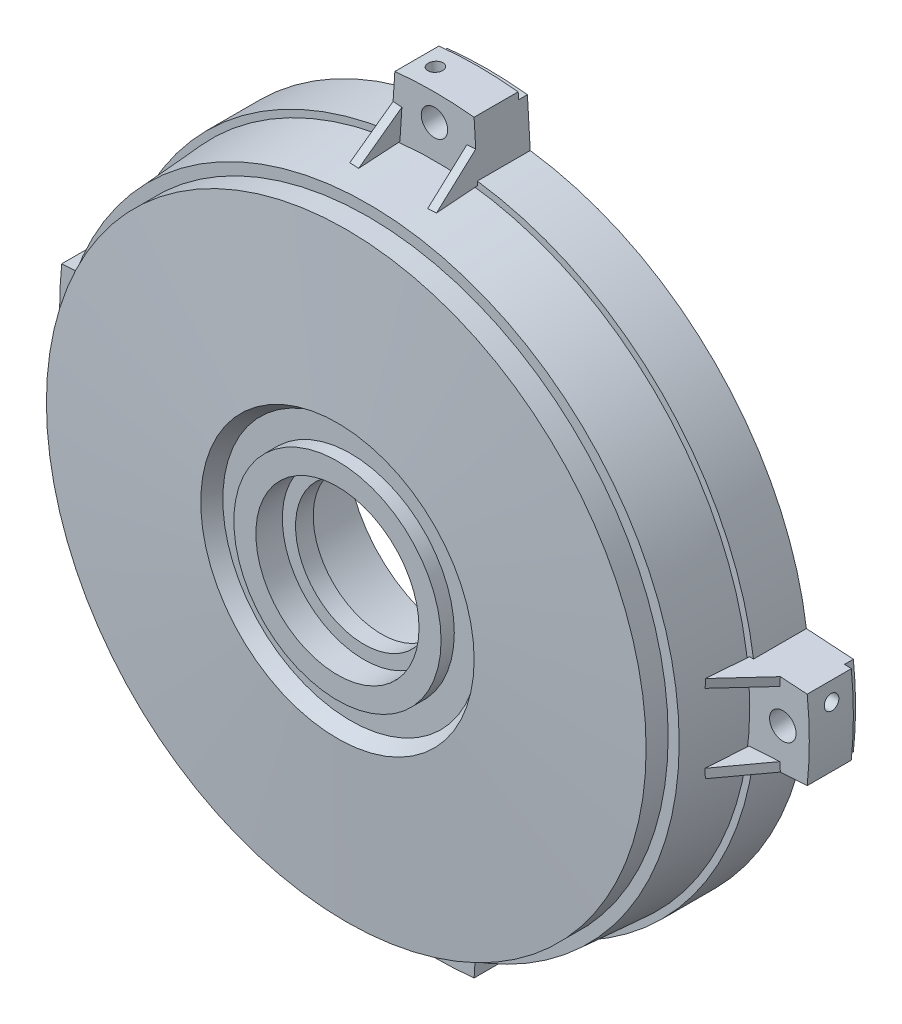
SolidWorks part; units mm, degrees
ref_plane "前视基准面" through (0, 0, 0) normal (0, 0, 1) x (1, 0, 0)
ref_plane "上视基准面" through (0, 0, 0) normal (0, 1, 0) x (1, 0, 0)
ref_plane "右视基准面" through (0, 0, 0) normal (1, 0, 0) x (0, 0, -1)
sketch "草图1" plane through (0, 0, 0) normal (0, 1, 0) x (1, 0, 0)
  line L0 (0, 0) -> (0, 28.0084) construction
  line L1 (15.5, 5.0884) -> (22.5, 5.0884)
  line L2 (22.5, 5.0884) -> (22.5, 6.0884)
  line L3 (22.5, 6.0884) -> (26, 6.0884)
  line L4 (26, 6.0884) -> (26, 23.0884)
  line L5 (26, 23.0884) -> (34, 23.0884)
  line L6 (34, 23.0884) -> (34, 4.0332)
  line L7 (15.5, 5.0884) -> (15.5, 1.0884)
  line L8 (15.5, 1.0884) -> (18.5, 1.0884)
  line L9 (18.5, 1.0884) -> (18.5, -4.9116)
  line L10 (18.5, -4.9116) -> (23.5, -4.9116)
  line L11 (23.5, -4.9116) -> (23.5, -1.9116)
  line L12 (23.5, -1.9116) -> (29, -1.9116)
  line L13 (29, -1.9116) -> (31, -4.9116)
  line L14 (31, -4.9116) -> (68, -2.9116)
  line L15 (68, -2.9116) -> (68, 2.0884)
  line L16 (68, 2.0884) -> (70.5, 2.0884)
  line L17 (70.5, 2.0884) -> (71.5, 17.0884)
  line L18 (71.5, 17.0884) -> (73, 17.0884)
  line L19 (73, 17.0884) -> (73, 29.0884)
  line L20 (73, 29.0884) -> (70, 29.0884)
  line L21 (67.2333, 5.5884) -> (70, 29.0884)
  line L22 (67.2333, 5.5884) -> (64.5, 5.5884)
  line L23 (64.5, 5.5884) -> (64.5, 0.4043)
  line L24 (64.5, 0.4043) -> (39.2699, -0.9595)
  arc A0 (39.2699, -0.9595) -> (34, 4.0332) centre (39, 4.0332) cw
  dimension "D25" = 5
  dimension "D1" = 15.5
  dimension "D2" = 22.5
  dimension "D3" = 26
  dimension "D4" = 1
  dimension "D5" = 17
  dimension "D6" = 34
  dimension "D7" = 18.5
  dimension "D8" = 23.5
  dimension "D9" = 6
  dimension "D10" = 3
  dimension "D11" = 29
  dimension "D12" = 31
  dimension "D13" = 2
  dimension "D14" = 5
  dimension "D15" = 68
  dimension "D16" = 70.5
  dimension "D17" = 71.5
  dimension "D18" = 73
  dimension "D19" = 24
  dimension "D20" = 70
  dimension "D21" = 34
  dimension "D22" = 12
  dimension "D23" = 3.5
  dimension "D24" = 3.5
revolve "旋转1" add sketch "草图1" angle 360 about L0
sketch "草图2" plane through (0, 0, -29.0884) normal (0, 0, -1) x (-1, 0, 0)
  circle A0 centre (0, 0) radius 70
extrude "切除-拉伸1" cut sketch "草图2" against normal blind 4
sketch "草图3" plane through (0, 0, -29.0884) normal (0, 0, -1) x (-1, 0, 0)
  line L0 (-8.9874, 84.5235) -> (-9.9009, 69.2963)
  line L1 (8.9874, 84.5235) -> (9.9745, 69.2857)
  arc A0 (8.9874, 84.5235) -> (-8.9874, 84.5235) centre (0, 0) ccw
  arc A1 (9.9745, 69.2857) -> (-9.9009, 69.2963) centre (0, 0) ccw
extrude "凸台-拉伸1" add sketch "草图3" against normal up to surface (12 mm away)
pattern_circular "阵列(圆周)1" count 4 over 360 about axis through (0, 0, 0) along (0, 0, 1) of "凸台-拉伸1"
sketch "草图4" plane through (0, 0, -29.0884) normal (0, 0, -1) x (-1, 0, 0)
  circle A0 centre (0, 0) radius 83.5
extrude "切除-拉伸2" cut sketch "草图4" against normal blind 2 flip side to cut
sketch "草图6" plane through (0, 0, 0) normal (0, 1, 0) x (1, 0, 0)
  line L0 (-64.5464, 0.4252) -> (-33.2767, -1.4057)
ref_plane "基准面1" through (-64.5464, 0, -0.4252) normal (0.9983, 0, 0.0585) x (0.0585, 0, -0.9983)
sketch "草图7" plane through (-64.5464, 0, -0.4252) normal (0.9983, 0, 0.0585) x (0.0585, 0, -0.9983)
  line L5 (-0.0934, 2) -> (-0.0934, -2)
  line L6 (-0.0934, 2) -> (2.9066, 2)
  line L7 (2.9066, 2) -> (2.9066, -2)
  line L8 (2.9066, -2) -> (-0.0934, -2)
sweep "扫描1" add profiles "草图7" path "草图6"
pattern_circular "阵列(圆周)3" count 8 over 360 about axis through (0, 0, 0) along (0, 0, 1) of "扫描1"
sketch "草图8" plane through (0, 0, -23.0884) normal (0, 0, -1) x (-1, 0, 0)
  circle A1 centre (0, 31) radius 5
extrude "凸台-拉伸2" add sketch "草图8" against normal blind 22
pattern_circular "阵列(圆周)4" count 3 over 360 about axis through (0, 0, 0) along (0, 0, 1) of "凸台-拉伸2"
sketch "草图9" plane through (0, 0, -23.0884) normal (0, 0, -1) x (-1, 0, 0)
  circle A1 centre (0, 31) radius 2.05
extrude "切除-拉伸4" cut sketch "草图9" against normal blind 2.05 draft 45
pattern_circular "阵列(圆周)5" count 3 over 360 about axis through (0, 0, 0) along (0, 0, 1) of "切除-拉伸4"
ref_plane "基准面2" through (85, 0, 0) normal (1, 0, 0) x (0, 0, -1)
hole_wizard "M4 螺纹孔1" positions "3D草图1" profile "草图10" tap size "M4" standard "GB"
sketch3d "3D草图1"
  point P0 (84.8543, 4.9752, -22.2864)
sketch "草图10" plane through (84.8543, 4.9752, -22.2864) normal (0, 0, 1) x (-0.0585, 0.9983, 0)
  line L0 (0, 0) -> (0, 9.9914)
  line L1 (0, 9.9914) -> (1.65, 9)
  line L2 (1.65, 9) -> (1.65, 0)
  line L5 (1.65, 0) -> (0, 0)
  line L10 (0, 9.9914) -> (-1.65, 9) construction
  line L11 (0, -6.35) -> (0, 107.95) construction
  dimension "螺纹孔钻头直径" = 3.3
  dimension "螺纹孔钻头深度" = 9
  dimension "导头角度" = 118
pattern_circular "阵列(圆周)6" count 4 over 360 about axis through (0, 0, 0) along (0, 0, 1) of "M4 螺纹孔1"
sketch "草图11" plane through (14.0078, 0.8404, 0) normal (0.9982, 0.0599, 0) x (0, 0, -1)
  line L0 (17.0884, 77.7361) -> (7.7308, 70.0802)
  line L1 (17.0884, 83.8336) -> (17.0884, 71.6385) construction
  line L2 (7.7308, 70.0802) -> (17.0884, 70.7659)
  line L3 (17.0884, 70.7659) -> (17.0884, 77.7361)
extrude "凸台-拉伸3" add sketch "草图11" against normal blind 2
pattern_circular "阵列(圆周)7" count 4 over 360 about axis through (0, 0, 0) along (0, 0, 1) of "凸台-拉伸3"
sketch "草图12" plane through (-14.4022, 0.933, 0) normal (-0.9979, 0.0646, 0) x (0, 0, 1)
  line L1 (-17.0884, 71.5591) -> (-17.0884, 83.7658) construction
  line L2 (-17.0884, 77.6624) -> (-17.0884, 70.6761)
  line L4 (-17.0884, 77.6624) -> (-7.7667, 70.0415)
  line L5 (-7.7667, 70.0415) -> (-17.0884, 70.6761)
extrude "凸台-拉伸4" add sketch "草图12" against normal blind 2
pattern_circular "阵列(圆周)8" count 4 over 360 about axis through (0, 0, 0) along (0, 0, 1) of "凸台-拉伸4"
sketch "草图14" plane through (0, 0, -29.0884) normal (0, 0, -1) x (-1, 0, 0)
  circle A1 centre (0, 79) radius 3
extrude "切除-拉伸5" cut sketch "草图14" against normal blind 30 contours A1
pattern_circular "阵列(圆周)9" count 4 over 360 about axis through (0, 0, 0) along (0, 0, 1) of "切除-拉伸5"
